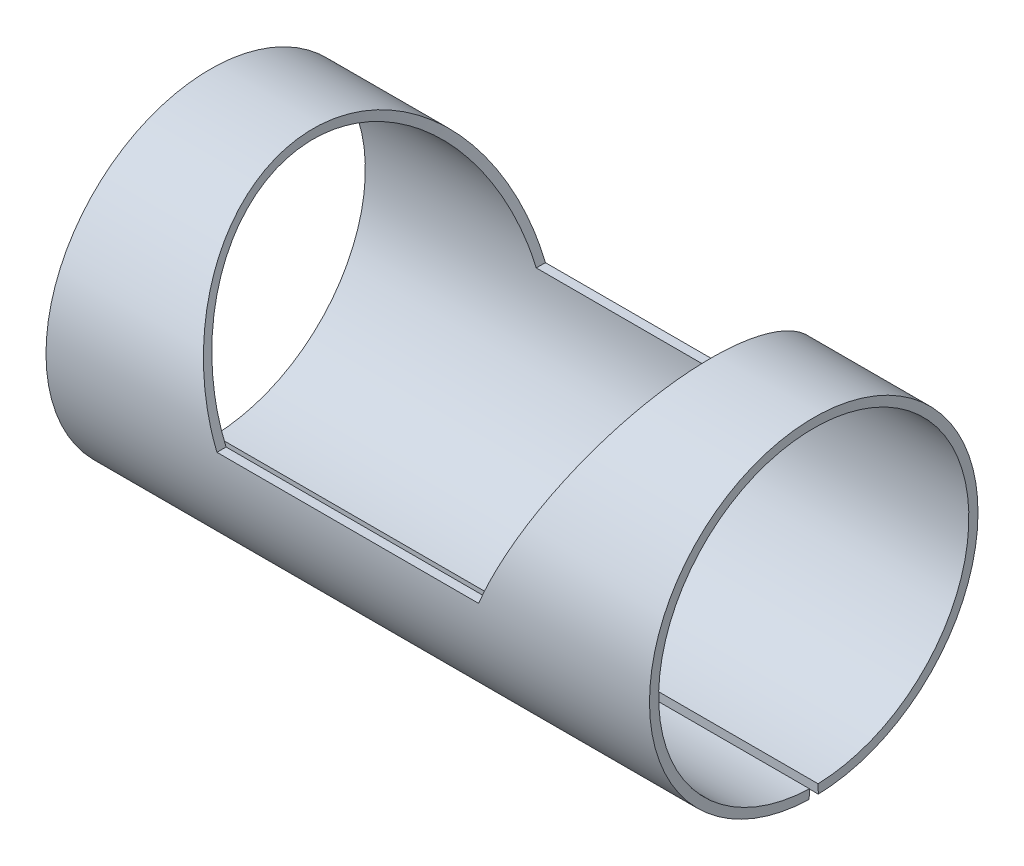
SolidWorks part; units mm, degrees
ref_plane "前视基准面" through (0, 0, 0) normal (0, 0, 1) x (1, 0, 0)
ref_plane "上视基准面" through (0, 0, 0) normal (0, 1, 0) x (1, 0, 0)
ref_plane "右视基准面" through (0, 0, 0) normal (1, 0, 0) x (0, 0, -1)
imported_body "基体零件-带补料的垂直三通管-1"
sheet metal parameters "钣金1" parameters "D1"=0.7366, "厚度"=1
bend "圆角折弯1" bend radius 16.963 bend angle 356.81 parameters "D5"=1
flatten bends "展开-折弯1"
sketch "尖角-草图1" plane through (0, -17.9561, -0.5) normal (0, -0.9996, -0.0278) x (1, 0, 0)
  line L0 (33, -52.8187) -> (-33, -52.8187) construction
  dimension "D1" = 0
process bends "加工-折弯1" parameters "D1"=0
sketch "平面-草图1" plane through (0, -17.9561, -0.5) normal (0, -0.9996, -0.0278) x (1, 0, 0)
